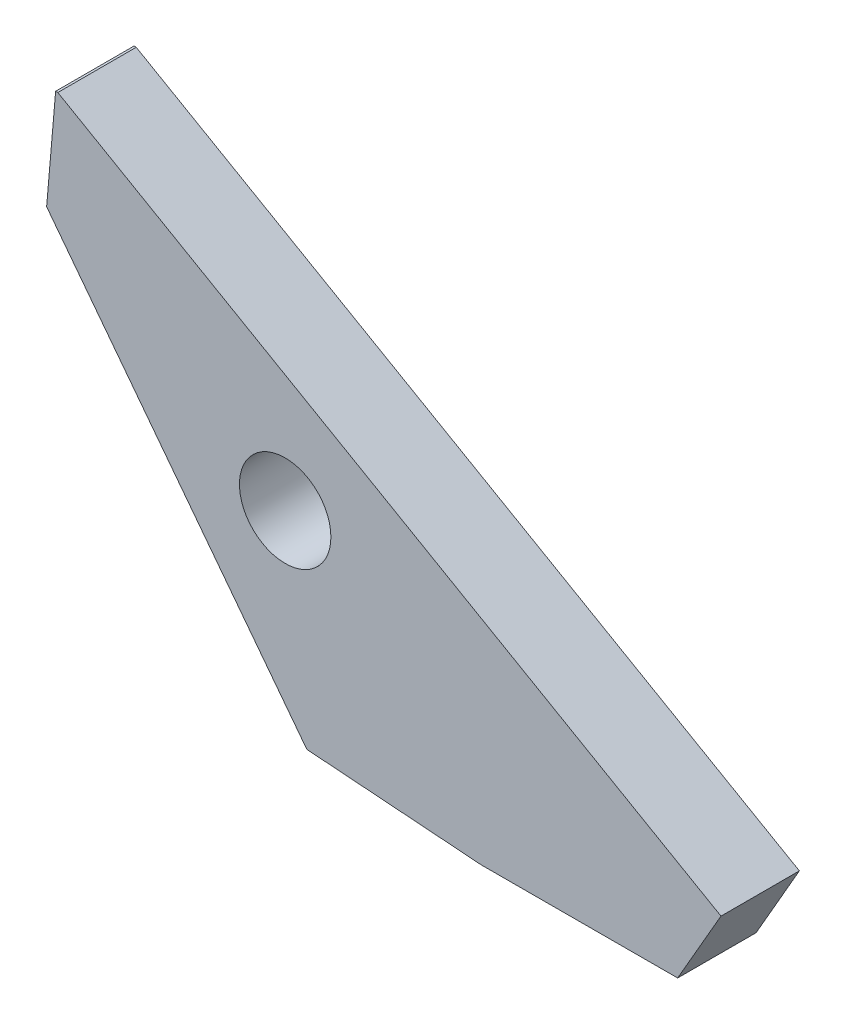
SolidWorks part; units mm, degrees
ref_plane "Plan de face" through (0, 0, 0) normal (0, 0, 1) x (1, 0, 0)
ref_plane "Plan de dessus" through (0, 0, 0) normal (0, 1, 0) x (1, 0, 0)
ref_plane "Plan de droite" through (0, 0, 0) normal (1, 0, 0) x (0, 0, -1)
sketch "Esquisse1" plane through (0, 0, 0) normal (0, 0, 1) x (1, 0, 0)
  line L0 (-87.006, 95.0749) -> (166.7933, -51)
  line L1 (166.7933, -51) -> (150.2189, -79.7974)
  line L2 (-91.2919, 55.0749) -> (-90, 70.0749)
  line L3 (-91.2919, 55.0749) -> (8.3, -74.9889)
  line L4 (150.2189, -79.7974) -> (75, -79.8989)
  line L5 (8.3, -74.9889) -> (75, -79.8989)
  line L6 (-87.8468, 95.0749) -> (-87.006, 95.0749)
  line L7 (-90, 70.0749) -> (-87.8468, 95.0749)
  circle A0 centre (0, 0) radius 17.5
  dimension "D11" = 35
  dimension "D2" = 8.3
  dimension "D3" = 39
  dimension "D4" = 25
  dimension "D5" = 5
  dimension "D6" = 30
  dimension "D7" = 90
  dimension "D8" = 170
  dimension "D9" = 39
  dimension "D10" = 75
  dimension "D12" = 80
  dimension "D13" = 15
  dimension "D14" = 65
  dimension "D15" = 51
  dimension "D16" = 90
extrude "Boss.-Extru.1" add sketch "Esquisse1" along normal blind 30
